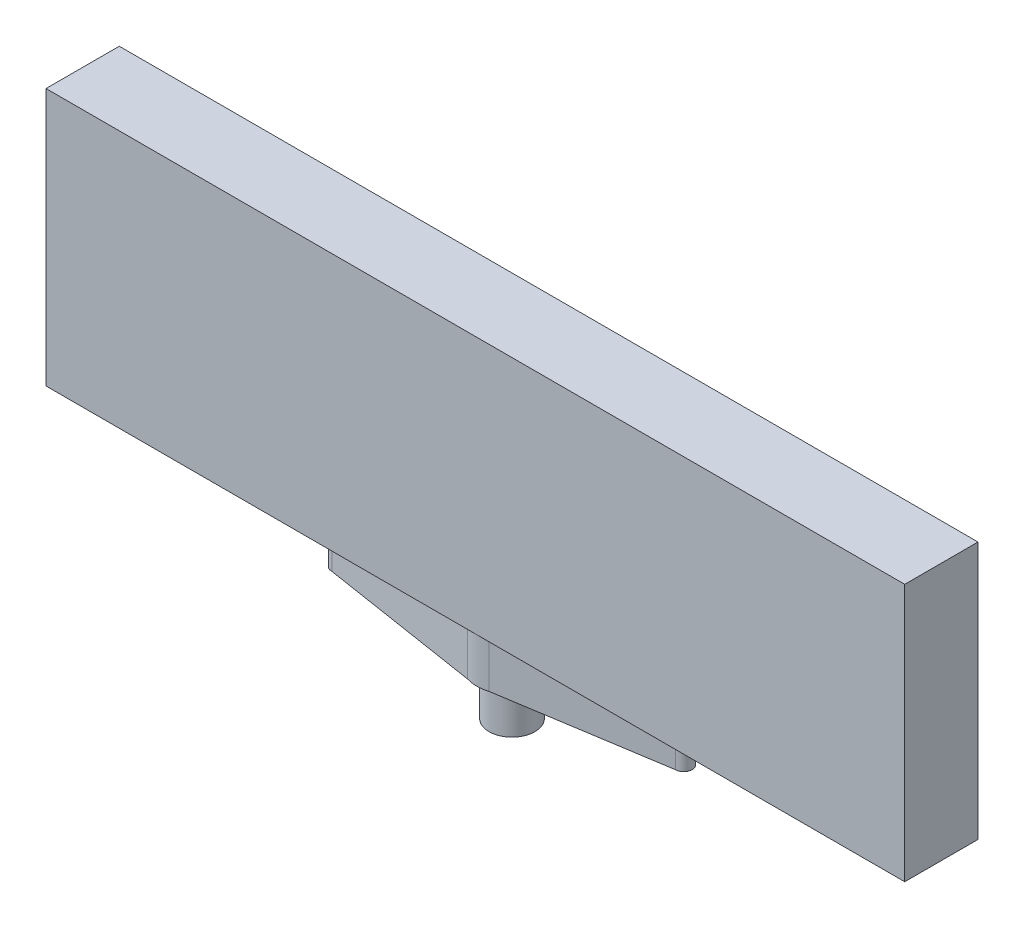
SolidWorks part; units mm, degrees
ref_plane "Front Plane" through (0, 0, 0) normal (0, 0, 1) x (1, 0, 0)
ref_plane "Top Plane" through (0, 0, 0) normal (0, 1, 0) x (1, 0, 0)
ref_plane "Right Plane" through (0, 0, 0) normal (1, 0, 0) x (0, 0, -1)
sketch "Sketch1" plane through (0, 0, 0) normal (0, 1, 0) x (1, 0, 0)
  circle A0 centre (0, 0) radius 2.54
  dimension "D1" = 5.08
extrude "Boss-Extrude1" add sketch "Sketch1" along normal blind 10.16
ref_plane "Plane1" through (0, 5.08, 0) normal (0, 1, 0) x (1, 0, 0)
sketch "Sketch2" plane through (0, 5.08, 0) normal (0, 1, 0) x (1, 0, 0)
  line L2 (-19.05, 0.939) -> (0, 3.937)
  line L3 (0, -3.937) -> (-19.05, -0.939)
  line L4 (19.05, 0.939) -> (0, 3.937)
  line L5 (0, -3.937) -> (19.05, -0.939)
  circle A0 centre (0, 0) radius 3.937
  arc A1 (-19.05, 0.939) -> (-19.05, -0.939) centre (-19.05, 0) ccw
  arc A2 (19.05, 0.939) -> (19.05, -0.939) centre (19.05, 0) cw
  dimension "D1" = 7.874
  dimension "D2" = 19.05
  dimension "D3" = 19.05
extrude "Boss-Extrude2" add sketch "Sketch2" along normal blind 5.08 contours A0 | L5 A2 L4 L2 A1 L3
sketch "Sketch3" plane through (0, 10.16, 0) normal (0, 1, 0) x (1, 0, 0)
  line L0 (0, 0) -> (0, 4.064)
  line L1 (0, 0) -> (0, -4.064)
  line L2 (0, 4.064) -> (47.625, 4.064)
  line L3 (0, -4.064) -> (47.625, -4.064)
  line L4 (0, -4.064) -> (-47.625, -4.064)
  line L5 (0, 4.064) -> (-47.625, 4.064)
  line L6 (-47.625, 4.064) -> (-47.625, -4.064)
  line L7 (47.625, 4.064) -> (47.625, -4.064)
  line L9 (-47.625, 4.064) -> (47.625, 4.064)
  line L10 (-47.625, 4.064) -> (-47.625, -4.064)
  line L11 (-47.625, -4.064) -> (47.625, -4.064)
  line L12 (47.625, 4.064) -> (47.625, -4.064)
  dimension "D1" = 4.064
  dimension "D2" = 47.625
extrude "Boss-Extrude3" add sketch "Sketch3" along normal blind 28.575 contours L10 L9 L12 L11
